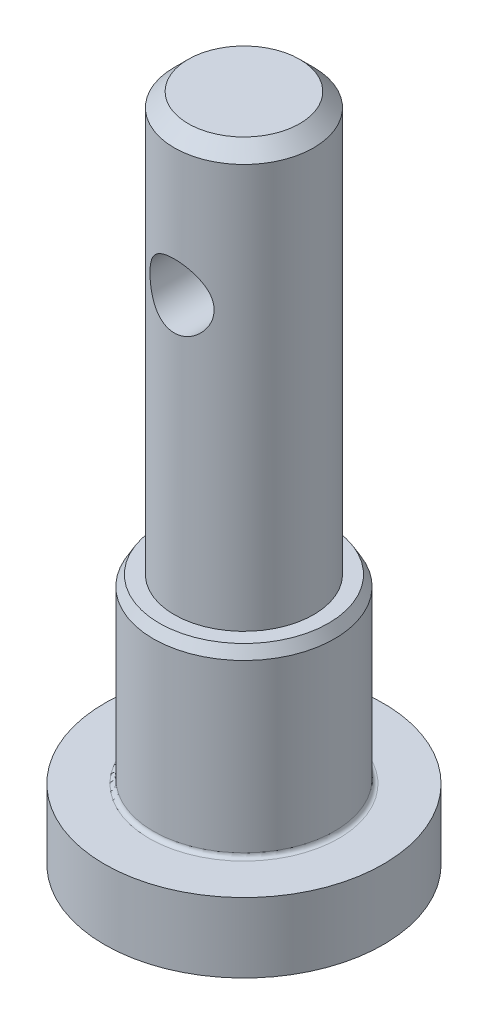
SolidWorks part; units mm, degrees
ref_plane "Plan1" through (0, 0, 0) normal (0, 0, 1) x (1, 0, 0)
ref_plane "Plan2" through (0, 0, 0) normal (0, 1, 0) x (1, 0, 0)
ref_plane "Plan3" through (0, 0, 0) normal (1, 0, 0) x (0, 0, -1)
sketch "Esquisse1" plane through (0, 0, 0) normal (0, 0, 1) x (1, 0, 0)
  line L0 (0, 49.5125) -> (0, -16.575) construction
  line L1 (5, 13) -> (6.5, 13)
  line L2 (6.5, 13) -> (6.5, 0)
  line L3 (6.5, 0) -> (10, 0)
  line L4 (10, 0) -> (10, -5)
  line L5 (10, -5) -> (0, -5)
  line L6 (5, 13) -> (5, 43)
  line L7 (5, 43) -> (0, 43)
  line L8 (0, 43) -> (0, -5)
  dimension "D1" = 5
  dimension "D2" = 13
  dimension "D3" = 30
  dimension "D4" = 5
  dimension "D5" = 6.5
  dimension "D6" = 10
revolve "Base-Révolution" add sketch "Esquisse1" angle 360 about L0
sketch "Esquisse2" plane through (0, 0, 0) normal (0, 0, 1) x (1, 0, 0)
  line L0 (0, 49.5125) -> (0, -16.575) construction
  line L2 (6.5, 13) -> (-6.5, 13) construction
  circle A0 centre (0, 32.8) radius 2.3
  dimension "D2" = 4.6
  dimension "D1" = 17.5
extrude "Enlèv. mat.-Extru.1" cut sketch "Esquisse2" against normal through all and the other way through all
chamfer "Chanfrein1" distance 0.75 angle 30
chamfer "Chanfrein3" distance 1 angle 45
fillet "Congé1" radius 0.3
